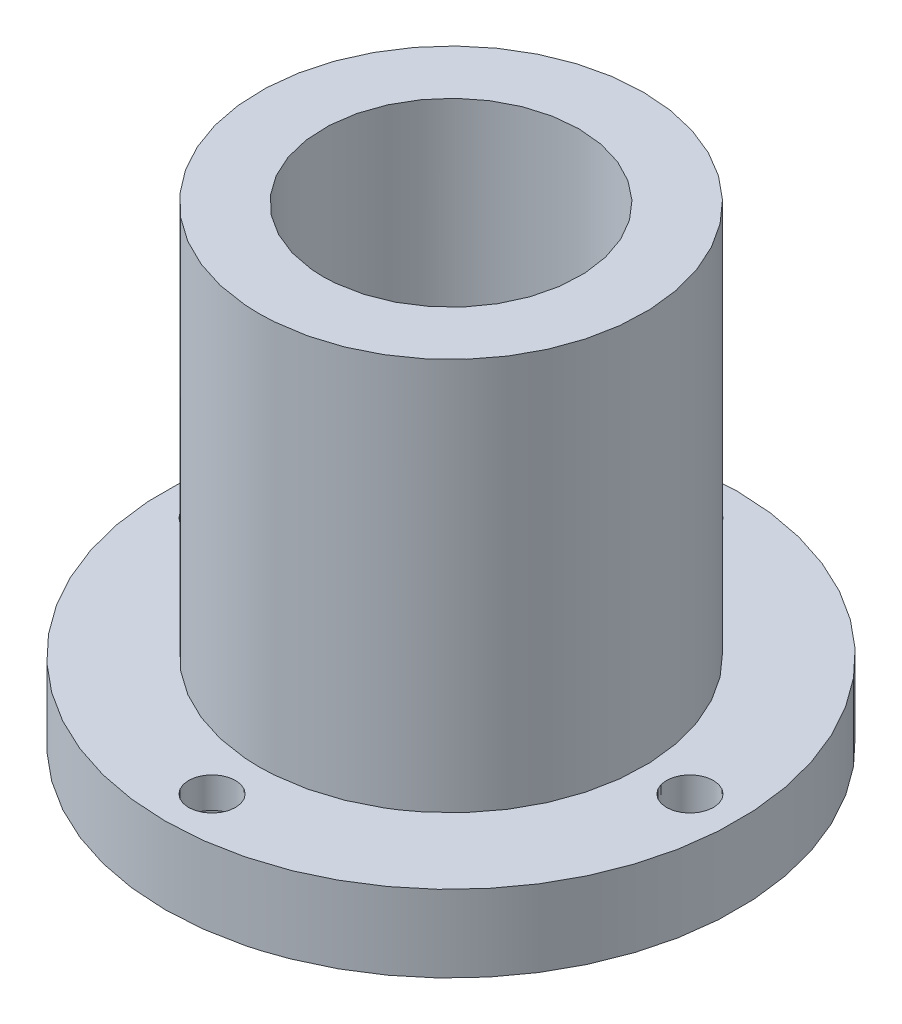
SolidWorks part; units mm, degrees
other "Solid1"
ref_plane "Front Plane" through (0, 0, 0) normal (0, 0, 1) x (1, 0, 0)
ref_plane "Top Plane" through (0, 0, 0) normal (0, 1, 0) x (1, 0, 0)
ref_plane "Right Plane" through (0, 0, 0) normal (1, 0, 0) x (0, 0, -1)
imported_body "2.7042 LMF60UU.stp<1>"
move or copy body "Body-Move/Copy1" bodies to move or copy 101 copy no rotation origin (55, 0, 0) rotation axis (0, 0, 1) rotation angle 90
